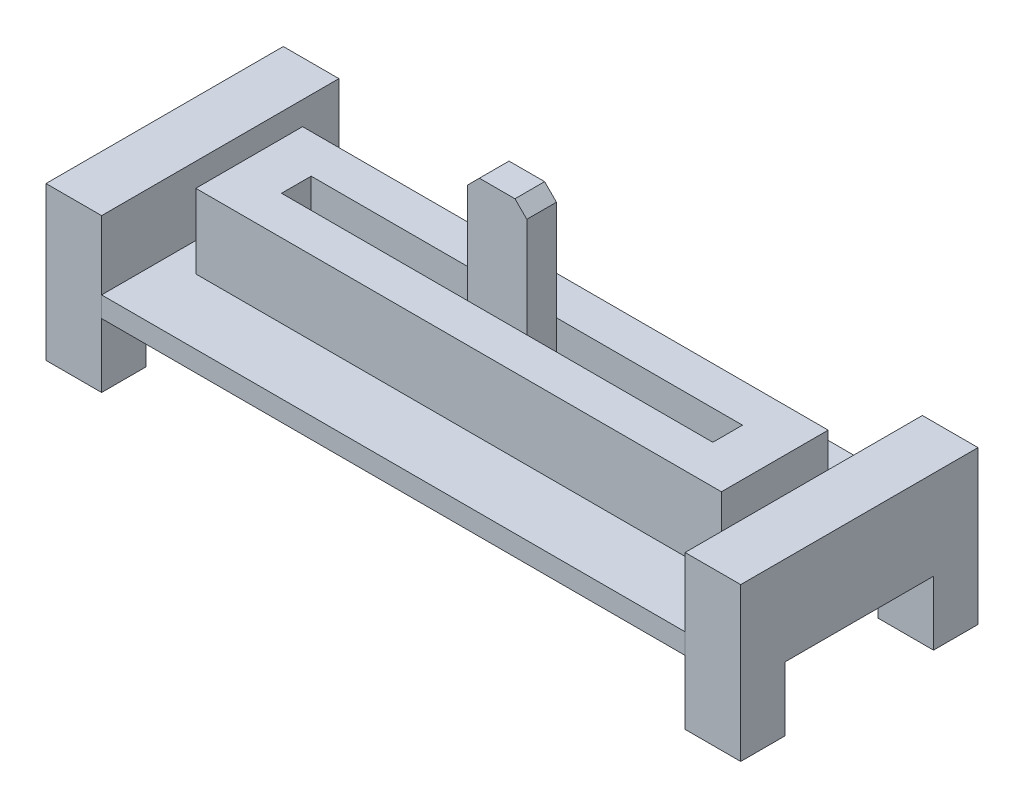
SolidWorks part; units mm, degrees
ref_plane "Front Plane" through (0, 0, 0) normal (0, 0, 1) x (1, 0, 0)
ref_plane "Top Plane" through (0, 0, 0) normal (0, 1, 0) x (1, 0, 0)
ref_plane "Right Plane" through (0, 0, 0) normal (1, 0, 0) x (0, 0, -1)
sketch "Sketch1" plane through (0, 0, 0) normal (0, 1, 0) x (1, 0, 0)
  line L1 (22.5044, -4.572) -> (-22.5044, -4.572)
  line L2 (22.5044, -4.572) -> (22.5044, 4.572)
  line L3 (22.5044, 4.572) -> (-22.5044, 4.572)
  line L4 (-22.5044, -4.572) -> (-22.5044, 4.572)
  line L5 (22.5044, -4.572) -> (-22.5044, 4.572) construction
  line L6 (22.5044, 4.572) -> (-22.5044, -4.572) construction
  point P0 (0, 0)
  dimension "D1" = 45.0088
  dimension "D2" = 9.144
extrude "Boss-Extrude1" add sketch "Sketch1" along normal blind 6.35
sketch "Sketch2" plane through (0, 6.35, 0) normal (0, 1, 0) x (1, 0, 0)
  line L1 (18.4658, -1.27) -> (-18.4658, -1.27)
  line L2 (18.4658, -1.27) -> (18.4658, 1.27)
  line L3 (18.4658, 1.27) -> (-18.4658, 1.27)
  line L4 (-18.4658, -1.27) -> (-18.4658, 1.27)
  line L5 (18.4658, -1.27) -> (-18.4658, 1.27) construction
  line L6 (18.4658, 1.27) -> (-18.4658, -1.27) construction
  point P0 (0, 0)
  dimension "D1" = 2.54
  dimension "D2" = 36.9316
extrude "Cut-Extrude1" cut sketch "Sketch2" against normal blind 3.175
sketch "Sketch3" plane through (0, 0, -1.27) normal (0, 0, 1) x (1, 0, 0)
  line L0 (0, 3.175) -> (0, 9.5568) construction
  line L1 (-18.4658, 3.175) -> (18.4658, 3.175) construction
  line L2 (-22.5044, 6.35) -> (22.5044, 6.35) construction
  line L3 (2.54, 15.9385) -> (-2.54, 15.9385)
  line L4 (2.54, 15.9385) -> (2.54, 3.175)
  line L5 (2.54, 3.175) -> (-2.54, 3.175)
  line L6 (-2.54, 15.9385) -> (-2.54, 3.175)
  line L7 (2.54, 15.9385) -> (-2.54, 3.175) construction
  line L8 (2.54, 3.175) -> (-2.54, 15.9385) construction
  dimension "D1" = 5.08
  dimension "D2" = 9.5885
extrude "Boss-Extrude2" add sketch "Sketch3" along normal up to surface (2.54 mm away)
chamfer "Chamfer1" distance 1.016 angle 45 2 edges at (-2.54, 15.9385, 0) (2.54, 15.9385, 0)
sketch "Sketch4" plane through (0, 0, 0) normal (0, -1, 0) x (1, 0, 0)
  line L1 (24.9809, -10.16) -> (-24.9809, -10.16)
  line L2 (24.9809, -10.16) -> (24.9809, 10.16)
  line L3 (24.9809, 10.16) -> (-24.9809, 10.16)
  line L4 (-24.9809, -10.16) -> (-24.9809, 10.16)
  line L5 (24.9809, -10.16) -> (-24.9809, 10.16) construction
  line L6 (24.9809, 10.16) -> (-24.9809, -10.16) construction
  point P0 (0, 0)
  dimension "D1" = 20.32
  dimension "D2" = 49.9618
extrude "Boss-Extrude3" add sketch "Sketch4" along normal blind 1.7526
sketch "Sketch6" plane through (-24.9809, 0, 0) normal (-1, 0, 0) x (0, 0, 1)
  line L0 (-10.16, -1.7526) -> (-10.16, 0) construction
  line L1 (-10.16, 5.8801) -> (10.16, 5.8801)
  line L2 (-10.16, 5.8801) -> (-10.16, -7.239)
  line L3 (-10.16, -7.239) -> (-6.35, -7.239)
  line L4 (10.16, 5.8801) -> (10.16, -7.239)
  line L5 (10.16, -1.7526) -> (10.16, 0) construction
  line L6 (10.16, 0) -> (-10.16, 0) construction
  line L7 (10.16, -1.7526) -> (-10.16, -1.7526) construction
  line L8 (-6.35, -1.7526) -> (0, -1.7526)
  line L9 (0, -1.7526) -> (6.35, -1.7526)
  line L10 (6.35, -1.7526) -> (6.35, -7.239)
  line L11 (-6.35, -1.7526) -> (-6.35, -7.239)
  line L12 (6.35, -7.239) -> (10.16, -7.239)
  dimension "D1" = 5.8801
  dimension "D2" = 5.4864
  dimension "D3" = 12.7
extrude "Boss-Extrude4" add sketch "Sketch6" along normal blind 4.7625 separate body
sketch "Sketch7" plane through (24.9809, 0, 0) normal (1, 0, 0) x (0, 0, -1)
  line L8 (10.16, -7.239) -> (10.16, 5.8801)
  line L9 (6.35, -7.239) -> (10.16, -7.239)
  line L10 (6.35, -1.7526) -> (6.35, -7.239)
  line L11 (-6.35, -1.7526) -> (6.35, -1.7526)
  line L12 (-6.35, -7.239) -> (-6.35, -1.7526)
  line L13 (-10.16, -7.239) -> (-6.35, -7.239)
  line L14 (-10.16, 5.8801) -> (-10.16, -7.239)
  line L15 (10.16, 5.8801) -> (-10.16, 5.8801)
  line L16 (10.16, -7.239) -> (10.16, 5.8801)
  line L17 (6.35, -7.239) -> (10.16, -7.239)
  line L18 (6.35, -1.7526) -> (6.35, -7.239)
  line L19 (-6.35, -1.7526) -> (6.35, -1.7526)
  line L20 (-6.35, -7.239) -> (-6.35, -1.7526)
  line L21 (-10.16, -7.239) -> (-6.35, -7.239)
  line L22 (-10.16, 5.8801) -> (-10.16, -7.239)
  line L23 (10.16, 5.8801) -> (-10.16, 5.8801)
  dimension "D1" = 0
extrude "Boss-Extrude5" add sketch "Sketch7" along normal blind 4.7625 separate body
